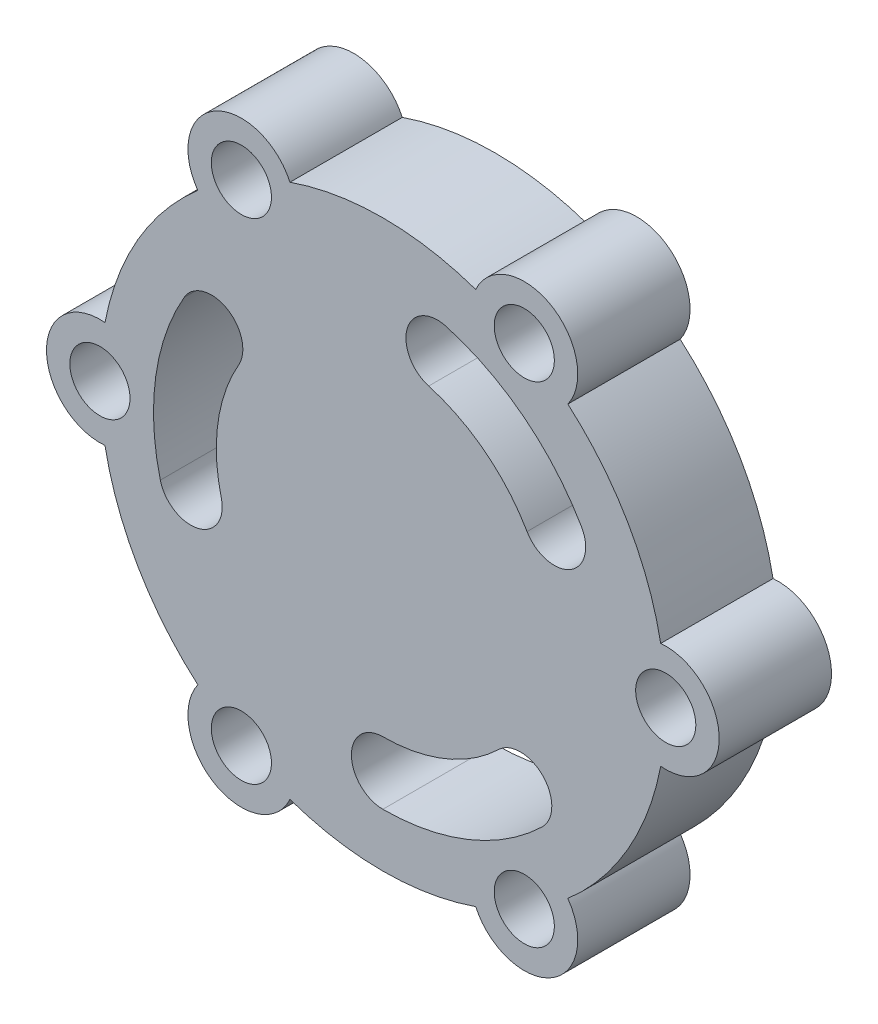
SolidWorks part; units mm, degrees
ref_plane "Front Plane" through (0, 0, 0) normal (0, 0, 1) x (1, 0, 0)
ref_plane "Top Plane" through (0, 0, 0) normal (0, 1, 0) x (1, 0, 0)
ref_plane "Right Plane" through (0, 0, 0) normal (1, 0, 0) x (0, 0, -1)
sketch "Sketch1" plane through (0, 0, 0) normal (0, 0, 1) x (1, 0, 0)
  circle A0 centre (0, 0) radius 35.2439 construction
  arc A1 (30.5221, 17.622) -> (9.7009, 33.8826) centre (0, 0) ccw construction
  arc A2 (35.3669, 20.4191) -> (11.2406, 39.2607) centre (0, 0) ccw
  arc A3 (25.6774, 14.8249) -> (8.1611, 28.5045) centre (0, 0) ccw
  arc A4 (25.6774, 14.8249) -> (35.3669, 20.4191) centre (30.5221, 17.622) ccw
  arc A5 (11.2406, 39.2607) -> (8.1611, 28.5045) centre (9.7009, 33.8826) ccw
  arc A6 (0, -35.2439) -> (24.4927, -25.3425) centre (0, 0) ccw construction
  arc A7 (0, -40.8381) -> (28.3804, -29.365) centre (0, 0) ccw
  arc A8 (0, -29.6498) -> (20.6051, -21.3199) centre (0, 0) ccw
  arc A9 (0, -29.6498) -> (0, -40.8381) centre (0, -35.2439) ccw
  arc A10 (28.3804, -29.365) -> (20.6051, -21.3199) centre (24.4927, -25.3425) ccw
  arc A11 (-30.5221, 17.622) -> (-34.1936, -8.5401) centre (0, 0) ccw construction
  arc A12 (-35.3669, 20.4191) -> (-39.6211, -9.8957) centre (0, 0) ccw
  arc A13 (-25.6774, 14.8249) -> (-28.7661, -7.1846) centre (0, 0) ccw
  arc A14 (-25.6774, 14.8249) -> (-35.3669, 20.4191) centre (-30.5221, 17.622) ccw
  arc A15 (-39.6211, -9.8957) -> (-28.7661, -7.1846) centre (-34.1936, -8.5401) ccw
  arc A16 (49.476, 9.4717) -> (32.9407, 38.1116) centre (0, 0) ccw
  circle A17 centre (50.3744, 0) radius 5.3545
  arc A18 (49.476, -9.4717) -> (49.476, 9.4717) centre (50.3744, 0) ccw
  circle A19 centre (25.1872, -43.6255) radius 5.3545
  arc A20 (16.5352, -47.5833) -> (32.9407, -38.1116) centre (25.1872, -43.6255) ccw
  circle A21 centre (-25.1872, -43.6255) radius 5.3545
  arc A22 (-32.9407, -38.1116) -> (-16.5352, -47.5833) centre (-25.1872, -43.6255) ccw
  circle A23 centre (-50.3744, 0) radius 5.3545
  arc A24 (-49.476, 9.4717) -> (-49.476, -9.4717) centre (-50.3744, 0) ccw
  circle A25 centre (-25.1872, 43.6255) radius 5.3545
  arc A26 (-16.5352, 47.5833) -> (-32.9407, 38.1116) centre (-25.1872, 43.6255) ccw
  circle A27 centre (25.1872, 43.6255) radius 5.3545
  arc A28 (32.9407, 38.1116) -> (16.5352, 47.5833) centre (25.1872, 43.6255) ccw
  arc A29 (32.9407, -38.1116) -> (49.476, -9.4717) centre (0, 0) ccw
  arc A30 (-16.5352, -47.5833) -> (16.5352, -47.5833) centre (0, 0) ccw
  arc A31 (-49.476, -9.4717) -> (-32.9407, -38.1116) centre (0, 0) ccw
  arc A32 (-32.9407, 38.1116) -> (-49.476, 9.4717) centre (0, 0) ccw
  arc A33 (16.5352, 47.5833) -> (-16.5352, 47.5833) centre (0, 0) ccw
  point P7 (21.6927, 27.777)
  point P14 (13.2092, -32.6749)
  point P21 (-34.9019, 4.898)
  point P26 (0, 0)
  point P53 (0, 0)
  dimension "D5" = 35.2439
  dimension "D1" = 3
  dimension "D2" = 6
  dimension "D3" = 11.1884
  dimension "D4" = 44.023
extrude "Boss-Extrude1" add sketch "Sketch1" along normal blind 20
